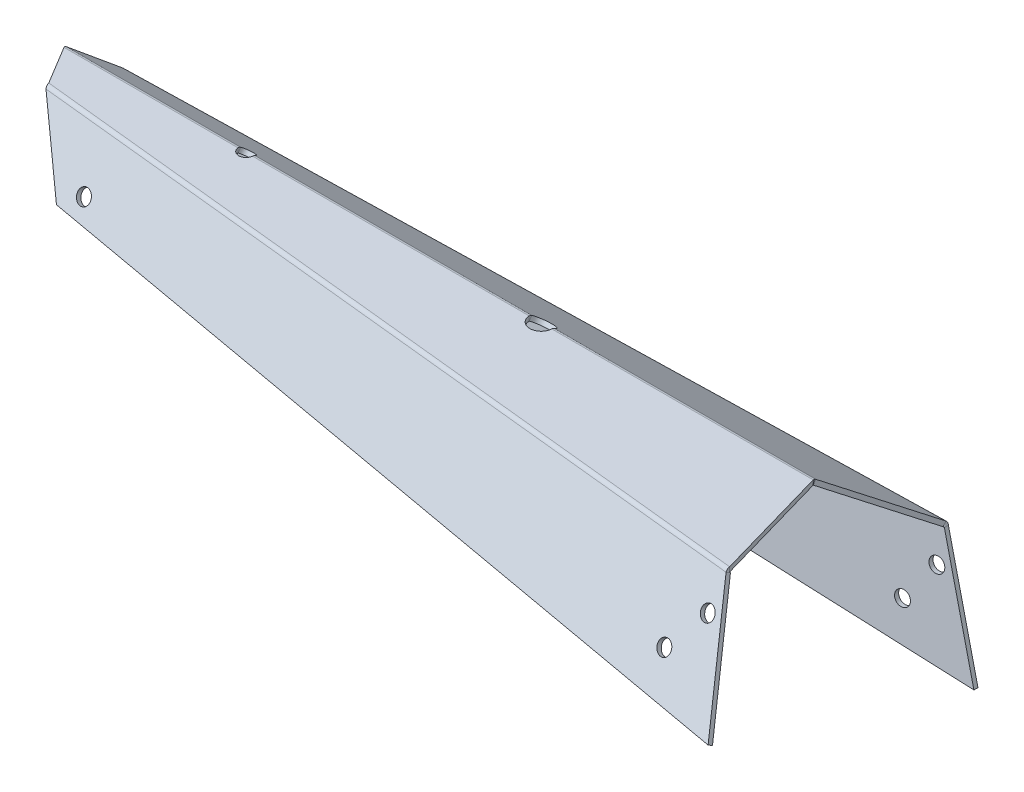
SolidWorks part; units mm, degrees
ref_plane "Front" through (0, 0, 0) normal (0, 0, 1) x (1, 0, 0)
ref_plane "Top" through (0, 0, 0) normal (0, 1, 0) x (1, 0, 0)
ref_plane "Right" through (0, 0, 0) normal (1, 0, 0) x (0, 0, -1)
sketch "Sketch1" plane through (0, 0, 0) normal (0, 1, 0) x (1, 0, 0)
  line L0 (92.1108, 41.9605) -> (92.1108, -41.9605) construction
  line L1 (92.1108, -0.0785) -> (107.1108, -0.0785) construction
  line L2 (92.1108, -25.0785) -> (107.1108, -25.0785) construction
  line L3 (92.1108, 24.9215) -> (107.1108, 24.9215) construction
  line L4 (-57.8483, 25) -> (107.1108, 52.5794)
  line L5 (-57.8483, -25) -> (107.1108, -52.5794)
  line L6 (92.1108, 49.9215) -> (107.1108, 49.9215) construction
  line L7 (92.1108, -50.0785) -> (107.1108, -50.0785) construction
  line L8 (107.1108, 52.5794) -> (92.1108, -0.0785)
  line L9 (-57.8483, 25) -> (-72.8892, -0.0785)
  line L10 (-72.8892, -0.0785) -> (-57.8483, -25)
  line L11 (92.1108, -0.0785) -> (107.1108, -52.5794)
  line L12 (-57.8483, 25) -> (-57.8483, -25) construction
  line L13 (-57.8483, 0) -> (-87.0002, 0) construction
  line L14 (-57.8483, 10) -> (-87.0002, 10) construction
  line L15 (-57.8483, -10) -> (-87.0002, -10) construction
  line L16 (-57.8483, 25) -> (-87.0002, 25) construction
  line L17 (-57.8483, -25) -> (-87.0002, -25) construction
  line L18 (92.1108, 24.9215) -> (-57.8483, 10) construction
  line L19 (-57.8483, -10) -> (92.1108, -25.0785) construction
  circle A0 centre (-32.8892, -0.0785) radius 1.6
  circle A1 centre (32.1108, -0.0785) radius 2.5
  circle A2 centre (-52.8483, 21.7804) radius 1.6
  circle A3 centre (-52.8483, -21.7804) radius 1.6
  circle A4 centre (92.1108, 41.9605) radius 1.6
  circle A5 centre (92.1108, -41.9605) radius 1.6
  circle A6 centre (98.5865, 33.6053) radius 1.6
  circle A7 centre (98.6176, -33.7731) radius 1.6
  dimension "D1" = 60
  dimension "D10" = 60
  dimension "D11" = 60
  dimension "D12" = 8
  dimension "D13" = 8
  dimension "D14" = 3
  dimension "D15" = 3
  dimension "D25" = 8
  dimension "D2" = 65
  dimension "D3" = 40
  dimension "D4" = 15
  dimension "D5" = 15
  dimension "D6" = 5
  dimension "D7" = 5
  dimension "D8" = 4
  dimension "D9" = 4
  dimension "D16" = 25
  dimension "D17" = 25
  dimension "D18" = 15
  dimension "D19" = 15
  dimension "D20" = 10
  dimension "D21" = 10
  dimension "D22" = 25
  dimension "D23" = 25
  dimension "D24" = 8
sheet metal parameters "Sheet-Metal1" thickness 1 parameters "D1"=0.01
base flange "Base-Flange1" sketch "Sketch1" thickness 1 reverse thickness direction yes parameters "D1"=0.01
sketch "Sketch3" plane through (0, 1, 0) normal (0, 1, 0) x (-1, 0, 0)
  line L6 (-101.3553, -26.4693) -> (73.8304, -8.3467)
  line L7 (70.6903, 8.6715) -> (-99.1202, 26.2381)
sketched bend "Sketched Bend1" parameters "D1"=0
bend "SketchBend1" bend radius 0.01 bend angle 62 parameters "D5"=1
bend "SketchBend2" bend radius 0 bend angle 62 parameters "D5"=2
sketch "Sketch4" plane through (0, 1, 0) normal (0, 1, 0) x (-1, 0, 0)
  line L0 (72.8892, 0.0785) -> (-92.1108, 0.0785)
sketched bend "Sketched Bend2" parameters "D1"=0.01
bend "SketchBend3" bend radius 0.01 bend angle 35 parameters "D5"=3
flat pattern "Flat-Pattern1"
sketch "Bend-Lines1" plane through (0, 1, 0) normal (0, 1, 0) x (-1, 0, 0)
  line L0 (-87.1517, 0) -> (72.8483, 0) construction
  line L1 (-94.4996, 25.7601) -> (67.4439, 9.0074) construction
  line L2 (67.4439, -9.0074) -> (-94.4996, -25.7601) construction
bend of the flat pattern "Flatten-<SketchBend1>1"
bend of the flat pattern "Flatten-<SketchBend2>1"
bend of the flat pattern "Flatten-<SketchBend3>1"
